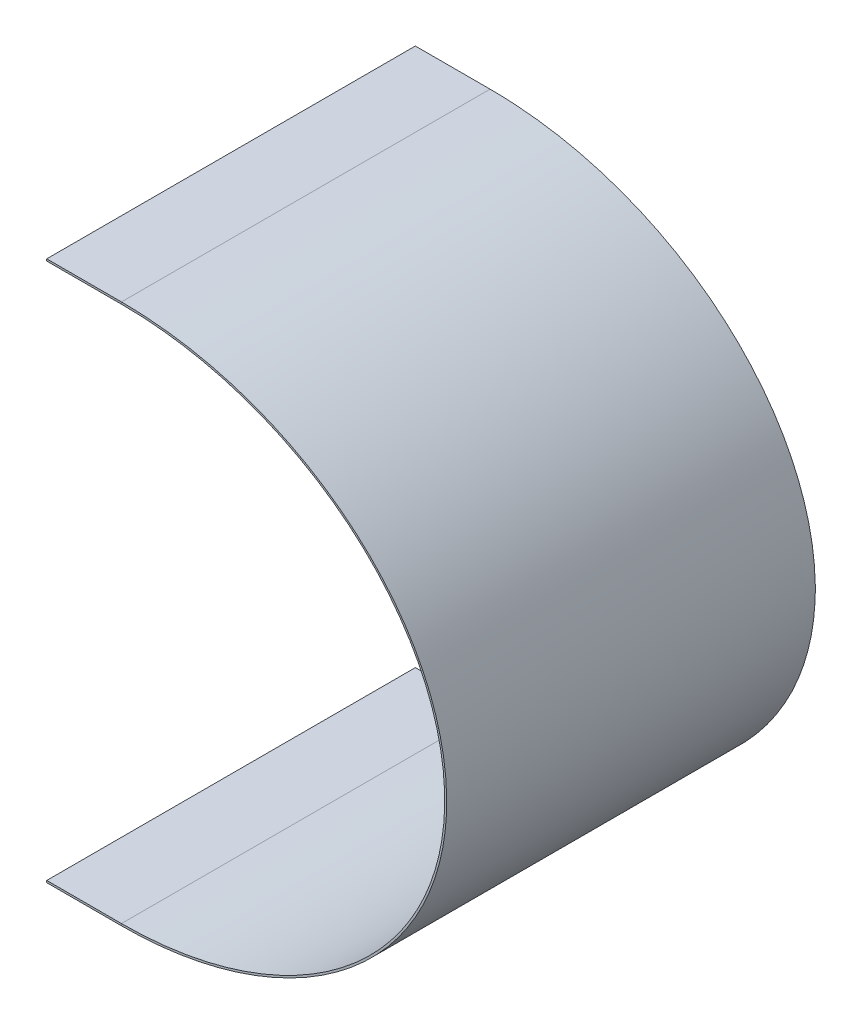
SolidWorks part; units mm, degrees
ref_plane "Ebene1" through (0, 0, 0) normal (0, 0, 1) x (1, 0, 0)
ref_plane "Ebene2" through (0, 0, 0) normal (0, 1, 0) x (1, 0, 0)
ref_plane "Ebene3" through (0, 0, 0) normal (1, 0, 0) x (0, 0, -1)
sketch "Skizze1" plane through (0, 0, 0) normal (0, 0, 1) x (1, 0, 0)
  line L0 (0, 161.522) -> (-45, 161.522)
  line L2 (0, 161.522) -> (0, -161.522) construction
  line L3 (0, -161.522) -> (-45, -161.522)
  ellipse E2 centre (0, 0) end of major axis (194.6965, 0) minor radius 161.522 (0, -161.522) -> (0, 161.522) ccw
  point P3 (0, 0)
  dimension "D2" = 45
ref_plane "Ebene4" through (0, 0, 222) normal (0, 0, 1) x (1, 0, 0)
sketch "Skizze2" plane through (0, 0, 222) normal (0, 0, 1) x (1, 0, 0)
  line L0 (0, 161.522) -> (-45, 161.522)
  line L1 (0, 161.522) -> (0, -161.522) construction
  line L2 (0, 161.522) -> (0, -161.522) construction
  line L3 (0, -161.522) -> (-45, -161.522)
  ellipse E2 centre (0, 0) end of major axis (194.6965, 0) minor radius 161.522 (0, -161.522) -> (0, 161.522) ccw
  point P3 (0, 0)
sheet metal parameters "Blech1" thickness 1.19 parameters "D1"=0, "Dicke"=1.19
lofted bend "Ausgeformte Biegungen1" parameters "D1"=0, "D12"=1.19
other "Freiform-Biegung1" parameters "D1"=1000, "D4"=57.296, "D5"=1
flat pattern "Abwicklung1"
sketch "Biegung-Linien1" plane through (0, 0, 0) normal (0, 1, 0) x (-1, 0, 0)
other "Abwickeln-<Freiform-Biegung1>1"
